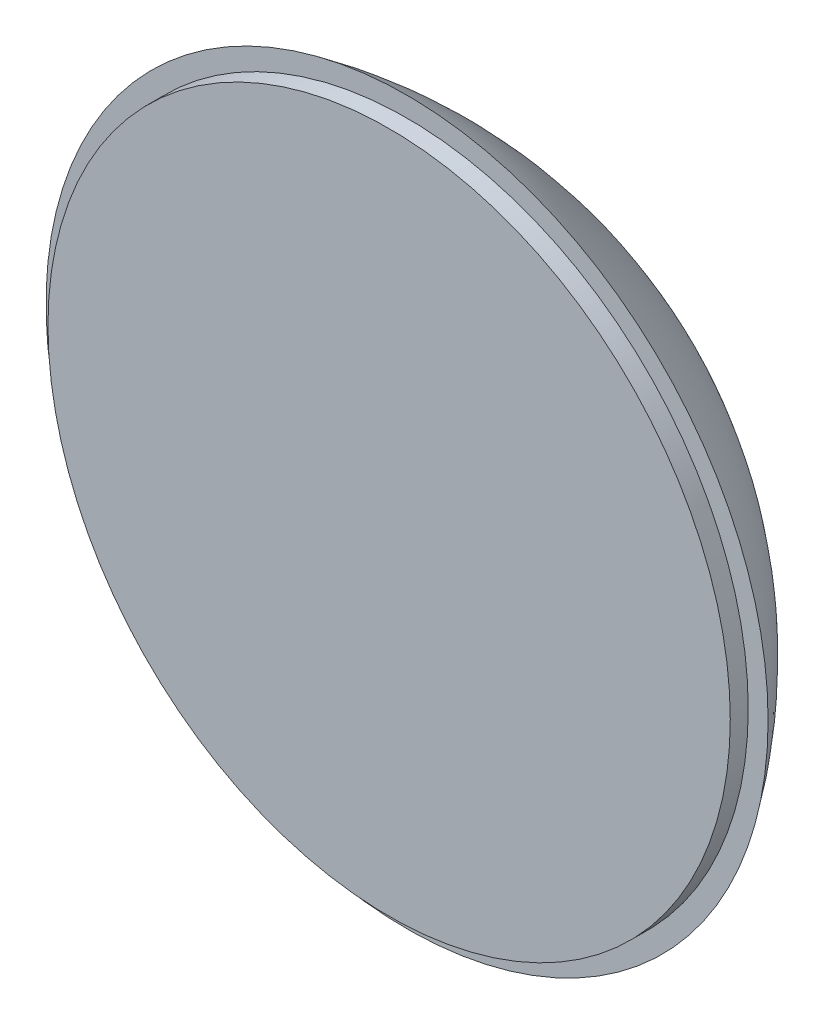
SolidWorks part; units mm, degrees
ref_plane "前视基准面" through (0, 0, 0) normal (0, 0, 1) x (1, 0, 0)
ref_plane "上视基准面" through (0, 0, 0) normal (0, 1, 0) x (1, 0, 0)
ref_plane "右视基准面" through (0, 0, 0) normal (1, 0, 0) x (0, 0, -1)
sketch "草图1" plane through (0, 0, 0) normal (0, 1, 0) x (1, 0, 0)
  line L0 (0, 0) -> (38, 0)
  line L1 (38, 0) -> (38, 2)
  line L2 (38, 2) -> (40.2119, 2)
  line L3 (0, 0) -> (0, 23)
  arc A0 (0, 23) -> (40.2119, 2) centre (0, -26) cw
  dimension "D1" = 49
  dimension "D2" = 23
  dimension "D3" = 2
  dimension "D4" = 38
revolve "旋转2" add sketch "草图1" angle 360 about L3
ref_plane "基准面1" through (3, 0, 0) normal (1, 0, 0) x (0, 0, -1)
sketch "草图2" plane through (3, 0, 0) normal (1, 0, 0) x (0, 0, -1)
  line L0 (24.6, 5) -> (31.8, 5)
  line L1 (24.6, -5) -> (31.8, -5)
  line L2 (31.8, 5) -> (31.8, -5)
  arc A0 (24.6, 5) -> (24.6, -5) centre (24.6, 0) ccw
  dimension "D1" = 5
  dimension "D2" = 7.2
  dimension "D3" = 24.6
sketch "草图3" plane through (0, 0, 0) normal (0, 1, 0) x (1, 0, 0)
  arc A0 (3, 19.6) -> (31, 7.5762) centre (0, -26) cw
  arc A1 (40.2119, 2) -> (-40.2119, 2) centre (0, -26) ccw construction
  dimension "D1" = 31
sweep "切除-扫描2" cut profiles "草图2" path "草图3"
mirror "镜向5" about plane through (0, 0, 0) normal (1, 0, 0) of "切除-扫描2"
